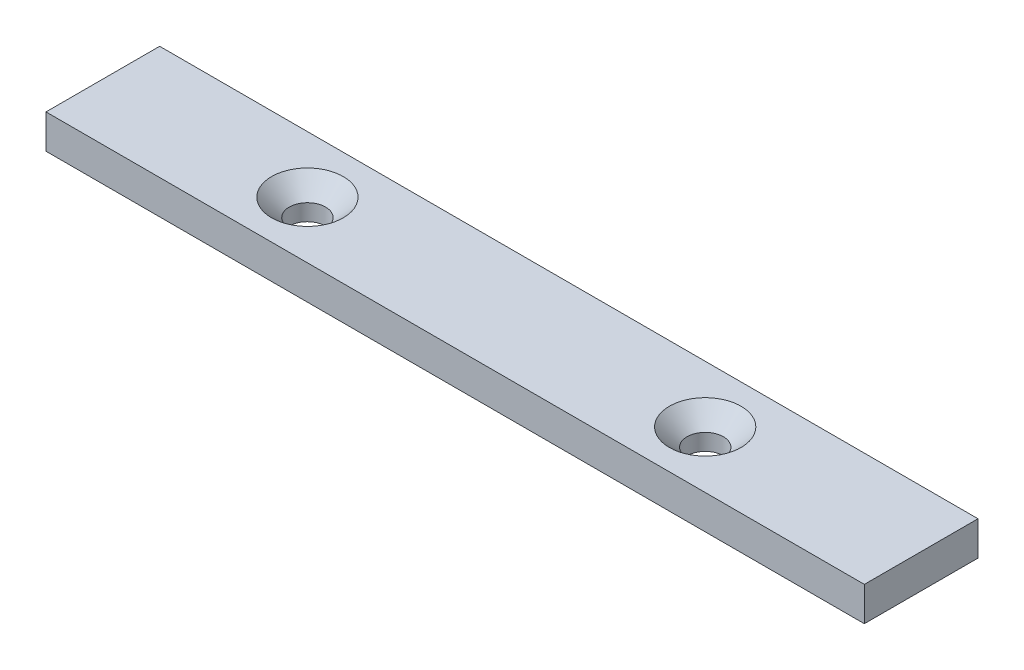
SolidWorks part; units mm, degrees
ref_plane "Front Plane" through (0, 0, 0) normal (0, 0, 1) x (1, 0, 0)
ref_plane "Top Plane" through (0, 0, 0) normal (0, 1, 0) x (1, 0, 0)
ref_plane "Right Plane" through (0, 0, 0) normal (1, 0, 0) x (0, 0, -1)
sketch "Sketch1" plane through (0, 0, 0) normal (0, 1, 0) x (1, 0, 0)
  line L1 (-72, -10) -> (72, -10)
  line L2 (-72, -10) -> (-72, 10)
  line L3 (-72, 10) -> (72, 10)
  line L4 (72, -10) -> (72, 10)
  line L5 (-72, -10) -> (72, 10) construction
  line L6 (-72, 10) -> (72, -10) construction
  point P0 (0, 0)
  dimension "D1" = 144
  dimension "D2" = 20
extrude "Boss-Extrude1" add sketch "Sketch1" along normal blind 6
hole_wizard "CSK for M6 Flat Head Machine Screw1" positions "Sketch3" profile "Sketch2" countersink size "M6" standard "ANSI Metric"
sketch "Sketch3" plane through (0, 6, 0) normal (0, 1, 0) x (-1, 0, 0)
  line L0 (-72, 10) -> (-72, -10) construction
  point P0 (36, 0)
  point P1 (-34, 0)
  dimension "D1" = 70
  dimension "D2" = 38
sketch "Sketch2" plane through (-36, 6, 0) normal (1, 0, 0) x (0, 0, 1)
  line L0 (0, 0) -> (0, 6)
  line L1 (0, 6) -> (3.2, 6)
  line L2 (3.2, 6) -> (3.2, 3.1)
  line L3 (3.2, 3.1) -> (6.3, 0)
  line L5 (6.3, 0) -> (0, 0)
  line L6 (-3.2, 3.1) -> (-6.3, 0) construction
  line L11 (0, -6.35) -> (0, 107.95) construction
  dimension "Thru Hole Dia." = 6.4
  dimension "Thru Hole Depth" = 6
  dimension "Near C'Sink Dia." = 12.6
  dimension "Near C'Sink Angle" = 90
